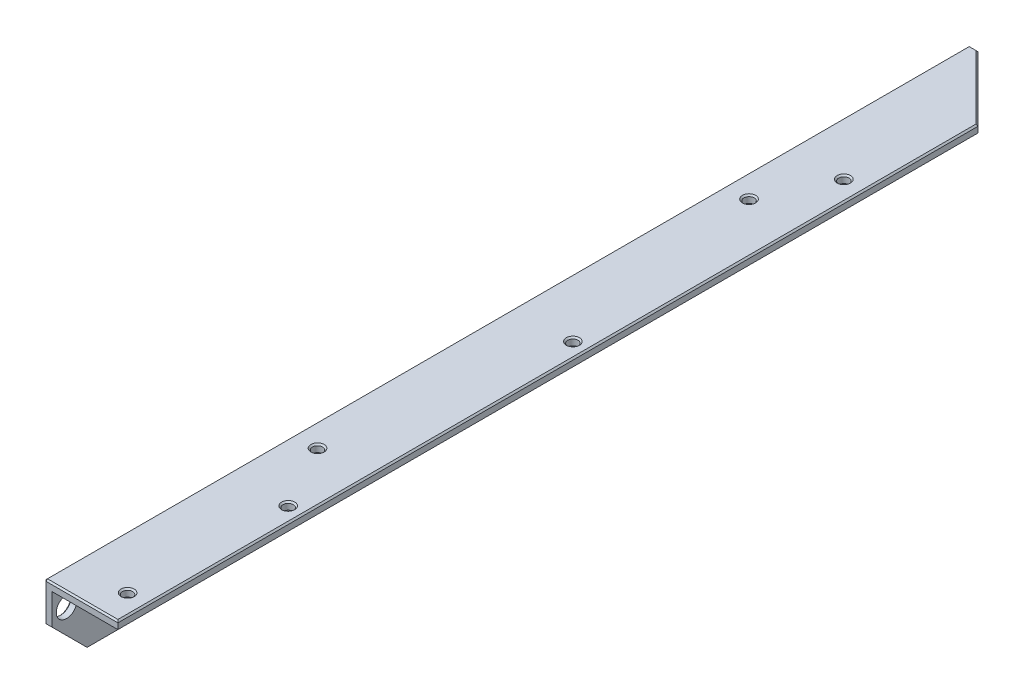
SolidWorks part; units mm, degrees
ref_plane "Plane1" through (0, 0, 0) normal (0, 0, 1) x (1, 0, 0)
ref_plane "Plane2" through (0, 0, 0) normal (0, 1, 0) x (1, 0, 0)
ref_plane "Plane3" through (0, 0, 0) normal (1, 0, 0) x (0, 0, -1)
sketch "Esquisse1" plane through (0, 0, 0) normal (0, 0, 1) x (1, 0, 0)
  line L0 (0, 0) -> (0, 25)
  line L1 (0, 25) -> (25, 25)
  line L2 (25, 25) -> (25, 22.5)
  line L3 (25, 22.5) -> (2.5, 22.5)
  line L4 (2.5, 22.5) -> (2.5, 0)
  line L5 (2.5, 0) -> (0, 0)
  dimension "D1" = 25
  dimension "D2" = 25
  dimension "D3" = 2.5
  dimension "D4" = 2.5
extrude "Base-Extrusion" add sketch "Esquisse1" along normal blind 315
sketch "Esquisse3" plane through (0, 25, 0) normal (0, 1, 0) x (-1, 0, 0)
  line L0 (0, 0) -> (-2.5, 0) construction
  line L1 (0, 315) -> (0, 0) construction
  line L2 (0, 315) -> (-25, 315) construction
  line L3 (-25, 315) -> (-25, 22) construction
  circle A0 centre (-18.3, 61) radius 1.75
  circle A1 centre (-8, 83) radius 1.75
  circle A2 centre (-20, 155) radius 1.75
  circle A3 centre (-8, 230) radius 1.75
  circle A4 centre (-20, 252) radius 1.75
  circle A5 centre (-18.3, 305) radius 1.75
  dimension "D1" = 3.5
  dimension "D2" = 3.5
  dimension "D3" = 3.5
  dimension "D10" = 3.5
  dimension "D11" = 3.5
  dimension "D17" = 3.5
  dimension "D4" = 61
  dimension "D5" = 83
  dimension "D6" = 8
  dimension "D7" = 18.3
  dimension "D8" = 20
  dimension "D9" = 160
  dimension "D12" = 10
  dimension "D13" = 18.3
  dimension "D14" = 8
  dimension "D15" = 85
  dimension "D16" = 63
  dimension "D18" = 5
extrude "Enlèv. mat.-Extru.2" cut sketch "Esquisse3" against normal blind 3
sketch "Esquisse5" plane through (0, 25, 0) normal (0, 1, 0) x (-1, 0, 0)
  line L0 (-3, 0) -> (-25, 22)
  line L1 (0, 0) -> (-25, 0) construction
  line L2 (-25, 315) -> (-25, 0) construction
  line L3 (-25, 22) -> (-25, 0)
  line L4 (-25, 0) -> (-3, 0)
  dimension "D1" = 45
  dimension "D2" = 22
extrude "Enlèv. mat.-Extru.5" cut sketch "Esquisse5" against normal blind 3
sketch "Esquisse6" plane through (0, 0, 0) normal (-1, 0, 0) x (0, 0, 1)
  line L0 (315, 12) -> (303, 0)
  line L1 (315, 0) -> (315, 25) construction
  line L2 (315, 0) -> (0, 0) construction
  line L3 (303, 0) -> (315, 0)
  line L4 (315, 0) -> (315, 12)
  dimension "D1" = 45
  dimension "D2" = 12
extrude "Enlèv. mat.-Extru.6" cut sketch "Esquisse6" against normal blind 3
sketch "Esquisse7" plane through (0, 0, 0) normal (-1, 0, 0) x (0, 0, 1)
  line L0 (255, 0) -> (255, 13.5)
  line L1 (303, 0) -> (0, 0) construction
  line L2 (257.5, 16) -> (272.5, 16)
  line L3 (275, 13.5) -> (275, 0)
  line L4 (315, 12) -> (315, 25) construction
  line L5 (255, 0) -> (275, 0)
  arc A0 (272.5, 16) -> (275, 13.5) centre (272.5, 13.5) cw
  arc A1 (255, 13.5) -> (257.5, 16) centre (257.5, 13.5) cw
  dimension "D1" = 2.5
  dimension "D2" = 2.5
  dimension "D3" = 60
  dimension "D4" = 20
  dimension "D5" = 16
extrude "Enlèv. mat.-Extru.9" cut sketch "Esquisse7" against normal blind 3
sketch "Esquisse8" plane through (0, 0, 0) normal (-1, 0, 0) x (0, 0, 1)
  line L0 (315, 12) -> (315, 25) construction
  line L1 (315, 25) -> (0, 25) construction
  line L2 (0, 0) -> (0, 25) construction
  circle A0 centre (310, 15.5) radius 3.5
  circle A1 centre (5, 15.5) radius 3.5
  dimension "D1" = 7
  dimension "D4" = 7
  dimension "D2" = 5
  dimension "D3" = 9.5
  dimension "D5" = 9.5
  dimension "D6" = 5
extrude "Enlèv. mat.-Extru.10" cut sketch "Esquisse8" against normal blind 3
chamfer "Chanfrein1" distance 0.5 angle 45
